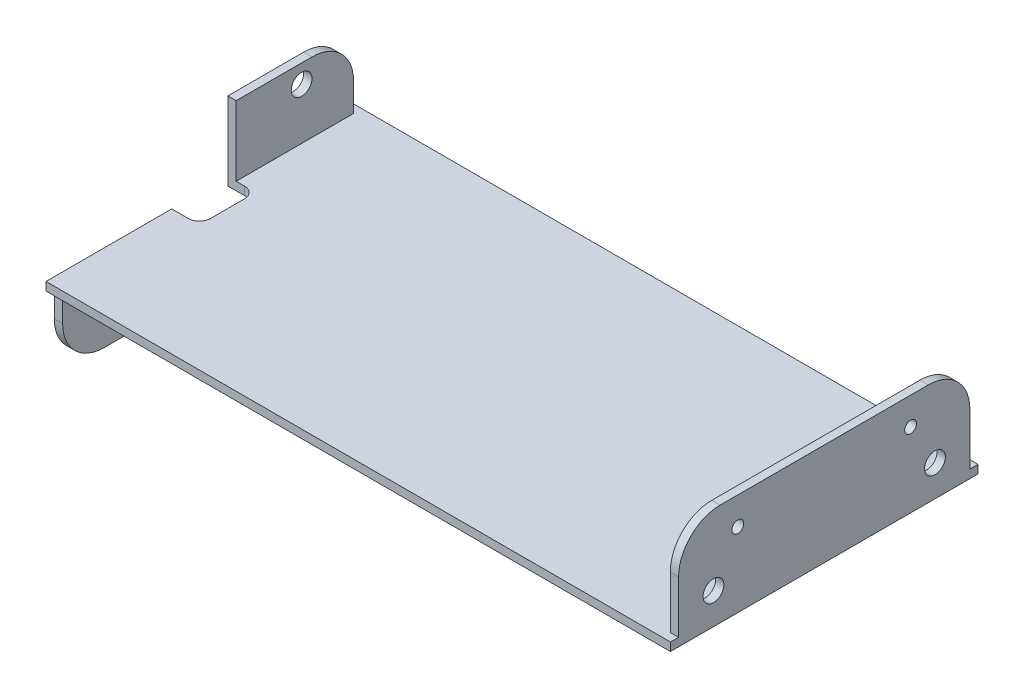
SolidWorks part; units mm, degrees
ref_plane "Front Plane" through (0, 0, 0) normal (0, 0, 1) x (1, 0, 0)
ref_plane "Top Plane" through (0, 0, 0) normal (0, 1, 0) x (1, 0, 0)
ref_plane "Right Plane" through (0, 0, 0) normal (1, 0, 0) x (0, 0, -1)
sketch "Sketch1" plane through (0, 0, 0) normal (0, 1, 0) x (1, 0, 0)
  line L1 (0, 0) -> (143.2052, 0)
  line L2 (0, 0) -> (0, 70.5358)
  line L3 (0, 70.5358) -> (143.2052, 70.5358)
  line L4 (143.2052, 0) -> (143.2052, 70.5358)
  dimension "D1" = 143.2052
  dimension "D2" = 70.5358
extrude "Boss-Extrude1" add sketch "Sketch1" along normal blind 1.905
sketch "Sketch5" plane through (0, 1.905, 0) normal (0, 1, 0) x (1, 0, 0)
  line L0 (143.2052, 0) -> (143.2052, 70.5358) construction
  line L1 (143.2052, 1.8669) -> (141.3002, 1.8669)
  line L2 (143.2052, 1.8669) -> (143.2052, 68.6689)
  line L3 (143.2052, 68.6689) -> (141.3002, 68.6689)
  line L4 (141.3002, 1.8669) -> (141.3002, 68.6689)
  line L5 (0, 0) -> (143.2052, 0) construction
  dimension "D1" = 1.905
  dimension "D2" = 1.8669
  dimension "D3" = 66.802
extrude "Boss-Extrude2" add sketch "Sketch5" along normal blind 21.4884
sketch "Sketch6" plane through (0, 1.905, 0) normal (0, 1, 0) x (1, 0, 0)
  line L0 (0, 70.5358) -> (0, 0) construction
  line L1 (0, 68.6308) -> (1.905, 68.6308)
  line L2 (0, 68.6308) -> (0, 41.7068)
  line L3 (0, 41.7068) -> (1.905, 41.7068)
  line L4 (1.905, 68.6308) -> (1.905, 41.7068)
  line L5 (143.2052, 70.5358) -> (0, 70.5358) construction
  dimension "D1" = 1.905
  dimension "D2" = 1.905
  dimension "D3" = 26.924
extrude "Boss-Extrude3" add sketch "Sketch6" along normal blind 16.002
sketch "Sketch7" plane through (0, 0, 0) normal (0, -1, 0) x (1, 0, 0)
  line L0 (0, -70.5358) -> (0, 0) construction
  line L1 (0, -1.905) -> (1.905, -1.905)
  line L2 (0, -1.905) -> (0, -28.829)
  line L3 (0, -28.829) -> (1.905, -28.829)
  line L4 (1.905, -1.905) -> (1.905, -28.829)
  line L5 (0, 0) -> (143.2052, 0) construction
  dimension "D1" = 1.905
  dimension "D2" = 26.924
  dimension "D3" = 1.905
extrude "Boss-Extrude4" add sketch "Sketch7" along normal blind 16.002
sketch "Sketch8" plane through (0, 0, 0) normal (-1, 0, 0) x (0, 0, 1)
  line L1 (-28.829, 0) -> (-41.7068, 0)
  line L2 (-28.829, 0) -> (-28.829, 1.905)
  line L3 (-28.829, 1.905) -> (-41.7068, 1.905)
  line L4 (-41.7068, 0) -> (-41.7068, 1.905)
extrude "Cut-Extrude1" cut sketch "Sketch8" against normal blind 6.35
sketch "Sketch9" plane through (0, 0, 0) normal (-1, 0, 0) x (0, 0, 1)
  line L0 (-1.905, -16.002) -> (-1.905, 0) construction
  line L1 (-28.829, 1.905) -> (0, 1.905) construction
  circle A0 centre (-16.0782, -9.2075) radius 2.3813
  dimension "D1" = 4.7625
  dimension "D2" = 14.1732
  dimension "D3" = 11.1125
extrude "Cut-Extrude2" cut sketch "Sketch9" against normal up to next
sketch "Sketch10" plane through (0, 0, 0) normal (-1, 0, 0) x (0, 0, 1)
  circle A0 centre (-56.7182, 13.6525) radius 2.3812
  circle A1 centre (-16.0782, -9.2075) radius 2.3813 construction
  dimension "D1" = 4.7625
  dimension "D2" = 40.64
  dimension "D3" = 22.86
extrude "Cut-Extrude3" cut sketch "Sketch10" against normal up to next
sketch "Sketch11" plane through (143.2052, 0, 0) normal (1, 0, 0) x (0, 0, -1)
  line L0 (1.8669, 23.3934) -> (1.8669, 1.905) construction
  line L1 (0, 0) -> (70.5358, 0) construction
  circle A0 centre (9.8679, 7.1628) radius 2.3813
  circle A1 centre (60.6679, 7.1628) radius 2.3813
  dimension "D1" = 4.7625
  dimension "D2" = 4.7625
  dimension "D3" = 50.8
  dimension "D4" = 8.001
  dimension "D5" = 7.1628
  dimension "D6" = 7.1628
extrude "Cut-Extrude4" cut sketch "Sketch11" against normal up to next
hole_wizard "#6-32 Tapped Hole1" positions "Sketch13" profile "Sketch12" tap size "#6-32" standard "ANSI Inch"
sketch "Sketch13" plane through (143.2052, 0, 0) normal (1, 0, 0) x (0, 0, -1)
  line L0 (0, 0) -> (70.5358, 0) construction
  line L1 (1.8669, 23.3934) -> (1.8669, 1.905) construction
  point P0 (15.4559, 17.0688)
  point P2 (55.0799, 17.0688)
  dimension "D1" = 17.0688
  dimension "D2" = 39.624
  dimension "D3" = 13.589
  dimension "D4" = 17.0688
sketch "Sketch12" plane through (143.2052, 17.0688, -15.4559) normal (0, 1, 0) x (0, 0, -1)
  line L0 (0, 0) -> (0, 1.905)
  line L1 (0, 1.905) -> (1.3525, 1.905)
  line L2 (1.3525, 1.905) -> (1.3525, 0)
  line L5 (1.3525, 0) -> (0, 0)
  line L11 (0, -6.35) -> (0, 107.95) construction
  dimension "Thru Tap Drill Dia." = 2.7051
  dimension "Thru Tap Drill Depth" = 1.905
fillet "Fillet1" radius 9.525 4 edges at (0.9525, -16.002, -1.905) (0.9525, 17.907, -68.6308) (142.2527, 23.3934, -68.6689) (142.2527, 23.3934, -1.8669)
fillet "Fillet2" radius 2.54 2 edges at (6.35, 0.9525, -28.829) (6.35, 0.9525, -41.7068)
